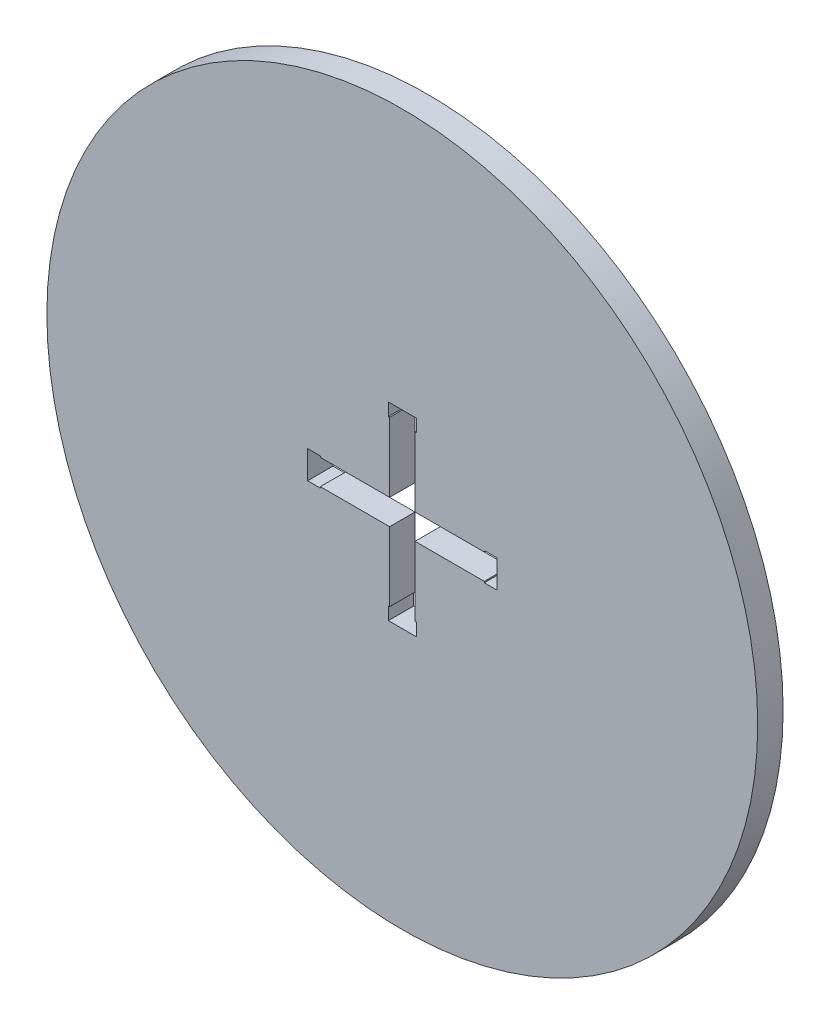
SolidWorks part; units mm, degrees
ref_plane "Alzado" through (0, 0, 0) normal (0, 0, 1) x (1, 0, 0)
ref_plane "Planta" through (0, 0, 0) normal (0, 1, 0) x (1, 0, 0)
ref_plane "Vista lateral" through (0, 0, 0) normal (1, 0, 0) x (0, 0, -1)
sketch "Croquis1" plane through (0, 0, 0) normal (0, 0, 1) x (1, 0, 0)
  circle A0 centre (0, 0) radius 177.8
  dimension "D1" = 355.6
extrude "Saliente-Extruir1" add sketch "Croquis1" along normal blind 12.7
sketch "Croquis3" plane through (0, 0, 0) normal (0, 0, 1) x (1, 0, 0)
  line L0 (0, 177.8) -> (0, -177.8) construction
  line L1 (-177.8, 0) -> (177.8, 0) construction
  line L2 (6.35, 47.371) -> (-6.35, 47.371)
  line L3 (-6.35, 47.371) -> (-6.35, 6.35)
  line L4 (-6.35, 6.35) -> (-47.371, 6.35)
  line L5 (-47.371, 6.35) -> (-47.371, -6.35)
  line L6 (-47.371, -6.35) -> (-6.35, -6.35)
  line L7 (-6.35, -6.35) -> (-6.35, -47.371)
  line L8 (-6.35, -47.371) -> (6.35, -47.371)
  line L9 (6.35, -6.35) -> (6.35, -47.371)
  line L10 (47.371, -6.35) -> (6.35, -6.35)
  line L11 (47.371, 6.35) -> (47.371, -6.35)
  line L12 (6.35, 6.35) -> (47.371, 6.35)
  line L13 (6.35, 47.371) -> (6.35, 6.35)
  circle A0 centre (0, 0) radius 177.8 construction
  point P9 (-47.371, 0)
  point P18 (0, -47.371)
  point P23 (0, 47.371)
  dimension "D1" = 6.35
  dimension "D2" = 94.742
  dimension "D3" = 94.742
  dimension "D4" = 12.7
extrude "Cortar-Extruir3" cut sketch "Croquis3" along normal through all
sketch "Croquis4" plane through (0, 0, 0) normal (0, 0, -1) x (-1, 0, 0)
  line L1 (-6.35, 47.371) -> (-6.985, 47.371)
  line L2 (-6.35, 47.371) -> (-6.35, 41.021)
  line L3 (-6.35, 41.021) -> (-6.985, 41.021)
  line L4 (-6.985, 47.371) -> (-6.985, 41.021)
  line L5 (-47.371, 6.35) -> (-41.021, 6.35)
  line L6 (-47.371, 6.35) -> (-47.371, 6.985)
  line L7 (-47.371, 6.985) -> (-41.021, 6.985)
  line L8 (-41.021, 6.35) -> (-41.021, 6.985)
  dimension "D1" = 6.35
  dimension "D2" = 0.635
  dimension "D3" = 0.635
  dimension "D4" = 6.35
extrude "Cortar-Extruir4" cut sketch "Croquis4" against normal through all
mirror "Simetría1" about plane through (0, 0, 0) normal (1, 0, 0) of "Cortar-Extruir4"
